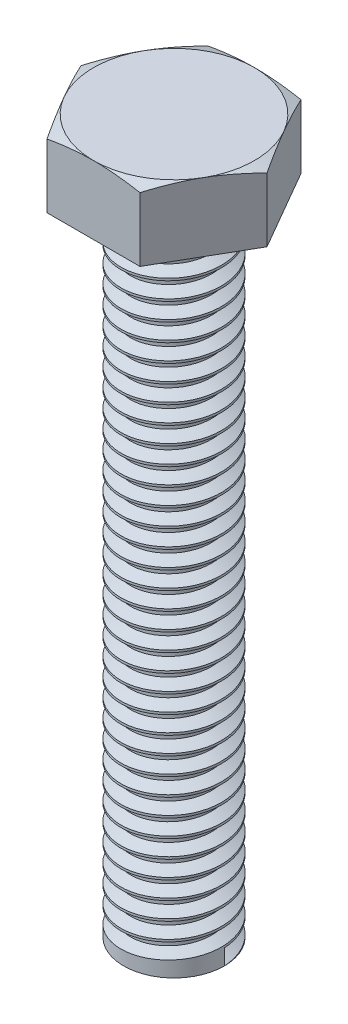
SolidWorks part; units mm, degrees
ref_plane "Front Plane" through (0, 0, 0) normal (0, 0, 1) x (1, 0, 0)
ref_plane "Top Plane" through (0, 0, 0) normal (0, 1, 0) x (1, 0, 0)
ref_plane "Right Plane" through (0, 0, 0) normal (1, 0, 0) x (0, 0, -1)
sketch "Sketch1" plane through (0, 0, 0) normal (0, 1, 0) x (1, 0, 0)
  circle A0 centre (0, 0) radius 3.9688
  dimension "D1" = 7.9375
extrude "Boss-Extrude1" add sketch "Sketch1" along normal blind 50.8
sketch "Sketch2" plane through (0, 50.8, 0) normal (0, 1, 0) x (1, 0, 0)
  line L1 (7.3323, 0) -> (3.6662, 6.35)
  line L2 (3.6662, 6.35) -> (-3.6662, 6.35)
  line L3 (-3.6662, 6.35) -> (-7.3323, 0)
  line L4 (-7.3323, 0) -> (-3.6662, -6.35)
  line L5 (-3.6662, -6.35) -> (3.6662, -6.35)
  line L6 (3.6662, -6.35) -> (7.3323, 0)
  circle A0 centre (0, 0) radius 6.35 construction
extrude "Boss-Extrude2" add sketch "Sketch2" along normal blind 5.3975
sketch "Sketch3" plane through (0, 0, 0) normal (1, 0, 0) x (0, 0, -1)
  line L0 (-6.35, 56.1975) -> (-10.6679, 56.1975)
  line L1 (-10.6679, 56.1975) -> (-10.6679, 54.6259)
  line L2 (-10.6679, 54.6259) -> (-6.35, 56.1975)
  line L3 (0, 56.1975) -> (0, 57.3105) construction
  dimension "D1" = 20
revolve "Cut-Revolve1" cut sketch "Sketch3" angle 360 about L3
thread "Thread1" pitch 1.4111 start angle 0, offset 0, length 50.8, pitch 1.4111, diameter 7.9375
ref_plane "Plane1" through (3.9688, 0, 0) normal (0, 0, 1) x (1, 0, 0)
sketch "Thread Profile1" plane through (3.9688, 0, 0) normal (0, 0, 1) x (1, 0, 0)
  line L0 (0, 0) -> (0, 1.4111) construction
  line L11 (0, 0) -> (0, 1.2347)
  line L12 (0, 1.2347) -> (-0.7638, 0.7937)
  line L13 (-0.7638, 0.7937) -> (-0.7638, 0.441)
  line L15 (-0.7638, 0.441) -> (0, 0)
  line L17 (-0.7638, 0.6174) -> (0, 0.6174) construction
  point P2 (0, 0)
  dimension "Pitch" = 1.4111
  dimension "Profile_Angle" = 60
  dimension "Profile_Land" = 0.3528
  dimension "Profile_Height" = 0.7638
